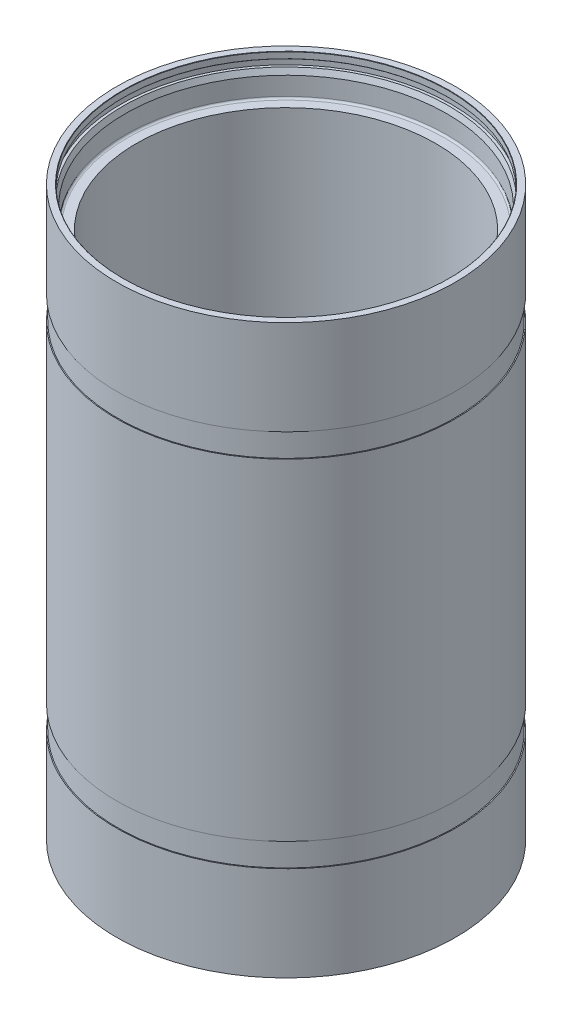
SolidWorks part; units mm, degrees
ref_plane "Front Plane" through (0, 0, 0) normal (0, 0, 1) x (1, 0, 0)
ref_plane "Top Plane" through (0, 0, 0) normal (0, 1, 0) x (1, 0, 0)
ref_plane "Right Plane" through (0, 0, 0) normal (1, 0, 0) x (0, 0, -1)
sketch "Sketch7" plane through (0, 0, 0) normal (0, 0, 1) x (1, 0, 0)
  line L0 (0, 0) -> (0, 241.062) construction
  line L1 (-136.525, 228.6) -> (-136.525, 152.4)
  line L2 (-136.525, 0) -> (-120.5611, 0)
  line L3 (-120.5611, 0) -> (-120.5611, 196.85)
  line L4 (-120.5611, 196.85) -> (-129.5654, 196.85)
  line L5 (-129.5654, 196.85) -> (-129.5654, 213.106)
  line L6 (-129.5654, 213.106) -> (-131.2295, 217.678)
  line L7 (-131.1275, 228.6) -> (-131.1275, 223.266)
  line L8 (-131.1275, 228.6) -> (-136.525, 228.6)
  line L9 (-131.1275, 223.266) -> (-133.35, 223.266)
  line L10 (-133.35, 223.266) -> (-133.35, 217.678)
  line L11 (-133.35, 217.678) -> (-131.2295, 217.678)
  line L12 (-136.525, 152.4) -> (-135.763, 152.4)
  line L13 (-135.763, 152.4) -> (-135.763, 133.35)
  line L14 (-135.763, 133.35) -> (-136.525, 133.35)
  line L15 (-136.525, 133.35) -> (-136.525, 0)
  dimension "D1" = 228.6
  dimension "D2" = 273.05
  dimension "D3" = 241.1222
  dimension "D4" = 259.1308
  dimension "D5" = 16.256
  dimension "D6" = 31.75
  dimension "D7" = 20
  dimension "D8" = 1.5621
  dimension "D9" = 5.334
  dimension "D10" = 5.588
  dimension "D11" = 3.7846
  dimension "D12" = 0.762
  dimension "D13" = 76.2
  dimension "D14" = 19.05
revolve "Revolve1" add sketch "Sketch7" angle 360 about L0
fillet "Fillet1" radius 1.524 1 edges at (0, 196.85, -129.5654)
chamfer "Chamfer1" distance 0.254 angle 45 2 edges at (0, 223.266, -131.1275) (0, 228.6, -131.1275)
mirror "Mirror1" of "Chamfer1", "Revolve1", "Fillet1"
